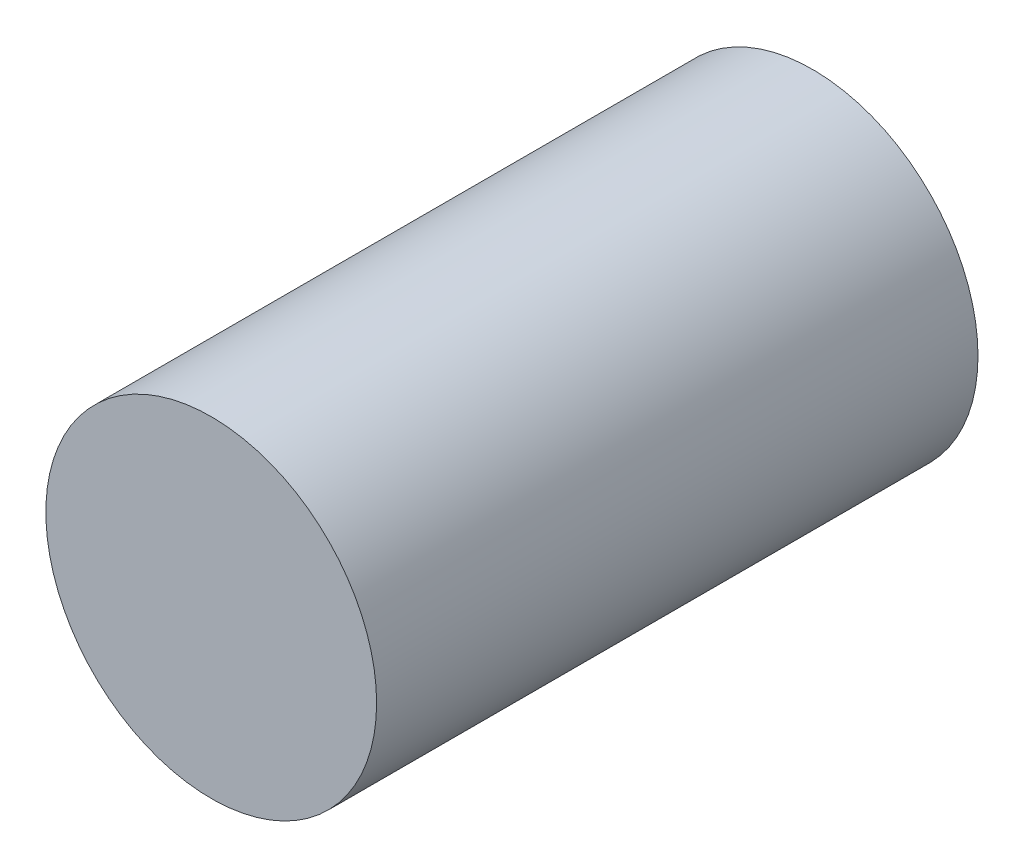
SolidWorks part; units mm, degrees
ref_plane "Plan de face" through (0, 0, 0) normal (0, 0, 1) x (1, 0, 0)
ref_plane "Plan de dessus" through (0, 0, 0) normal (0, 1, 0) x (1, 0, 0)
ref_plane "Plan de droite" through (0, 0, 0) normal (1, 0, 0) x (0, 0, -1)
sketch "Esquisse1" plane through (0, 0, 0) normal (0, 0, 1) x (1, 0, 0)
  circle A0 centre (0, 0) radius 11
extrude "Extrusion1" add sketch "Esquisse1" along normal blind 40
sketch "Esquisse2" plane through (0, 0, 0) normal (0, 0, -1) x (-1, 0, 0)
  circle A0 centre (0, 0) radius 6
extrude "Extrusion2" add sketch "Esquisse2" along normal blind 1
